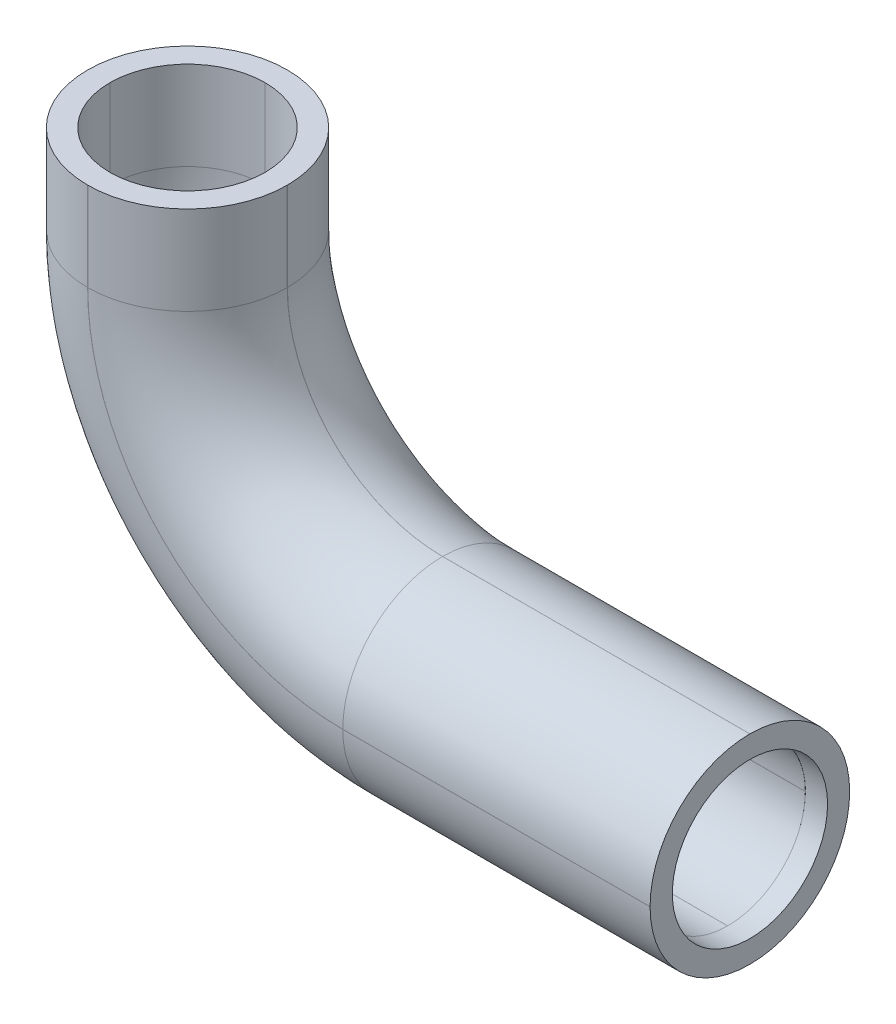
SolidWorks part; units mm, degrees
ref_plane "Front Plane" through (0, 0, 0) normal (0, 0, 1) x (1, 0, 0)
ref_plane "Top Plane" through (0, 0, 0) normal (0, 1, 0) x (1, 0, 0)
ref_plane "Right Plane" through (0, 0, 0) normal (1, 0, 0) x (0, 0, -1)
sketch "Sketch1" plane through (0, 0, 0) normal (0, 0, 1) x (1, 0, 0)
  line L1 (0, 0) -> (94.7928, 0)
  line L2 (0, 0) -> (0, 63.5)
  line L3 (0, 63.5) -> (28.575, 63.5)
  line L4 (94.7928, 0) -> (94.7928, 28.575)
  line L6 (28.575, 63.5) -> (28.575, 28.575)
  line L7 (28.575, 28.575) -> (94.7928, 28.575)
  dimension "D1" = 28.575
  dimension "D2" = 28.575
  dimension "D3" = 63.5
  dimension "D4" = 94.7928
extrude "Boss-Extrude1" add sketch "Sketch1" against normal blind 28.575
fillet "Fillet4" radius 22.225 1 edges at (28.575, 28.575, -14.2875)
fillet "Fillet5" radius 50.8 1 edges at (0, 0, -14.2875)
fillet "Fillet6" radius 14.2748 12 edges at (72.7964, 0, -28.575) (0, 57.15, -28.575) (0, 57.15, 0) (72.7964, 0, 0) (28.575, 57.15, -28.575) (72.7964, 28.575, -28.575) (72.7964, 28.575, 0) (28.575, 57.15, 0) (14.879, 14.879, -28.575) (14.879, 14.879, 0) (35.0846, 35.0846, -28.575) (35.0846, 35.0846, 0)
shell "Shell2" thickness 3.175
sketch "Sketch2" plane through (94.7928, 0, 0) normal (1, 0, 0) x (0, 0, -1)
  circle A0 centre (14.3002, 14.3002) radius 11.1125
  dimension "D1" = 22.225
extrude "Cut-Extrude1" cut sketch "Sketch2" against normal blind 3.175
